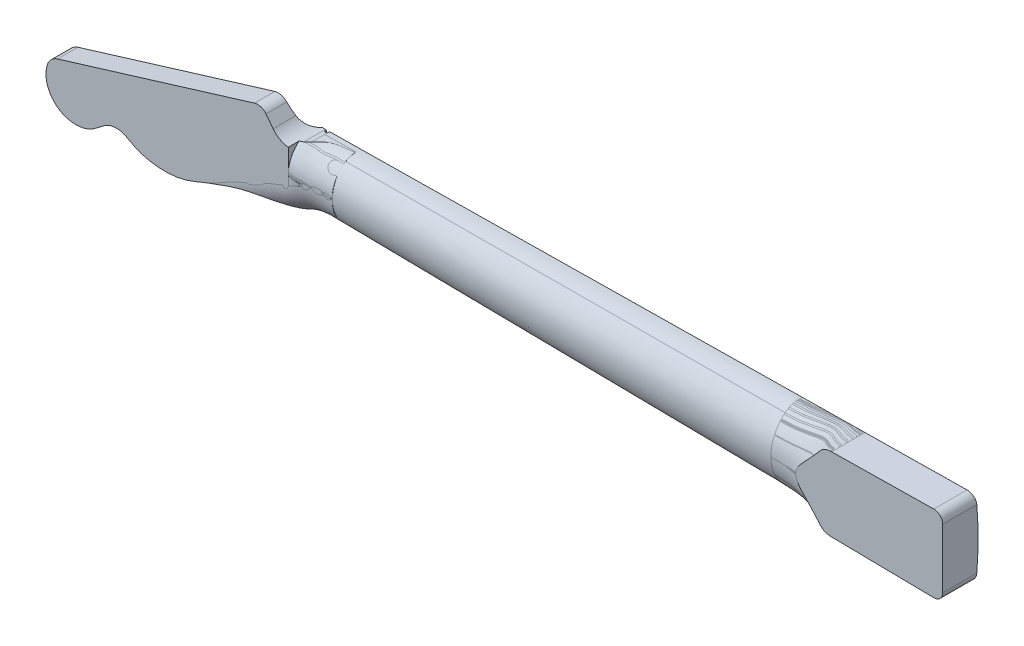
SolidWorks part; units mm, degrees
ref_plane "Ebene vorne" through (0, 0, 0) normal (0, 0, 1) x (1, 0, 0)
ref_plane "Ebene oben" through (0, 0, 0) normal (0, 1, 0) x (1, 0, 0)
ref_plane "Ebene rechts" through (0, 0, 0) normal (1, 0, 0) x (0, 0, -1)
imported_body "Part-1-1-solid1"
imported_body "Part-2-1-solid1"
imported_body "Part-3-1-solid1"
combine bodies "Kombinieren2" operation type add bodies to combine 101 102
ref_plane "Ebene1" through (525.2987, 0, 0) normal (-1, 0, 0) x (0, 0, 1)
other "Oberflächenschnitt1"
other "Fläche löschen5"
other "Fläche löschen1"
other "Fläche löschen2"
other "Fläche löschen3"
other "Fläche löschen4"
surface "Oberfläche-Zusammenfügen1"
other "Fläche löschen7"
other "Fläche löschen8"
other "Fläche löschen9"
